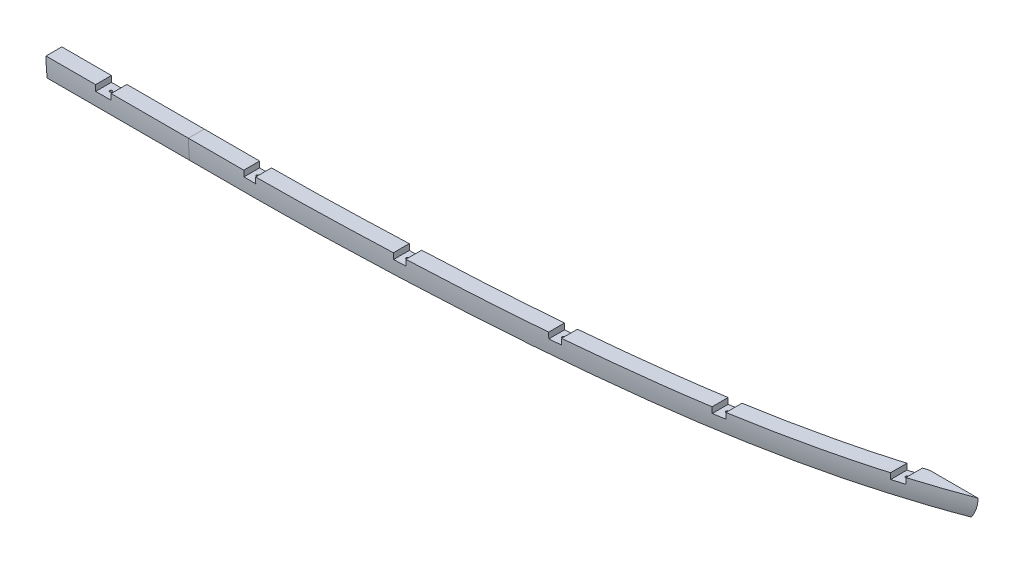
SolidWorks part; units mm, degrees
ref_plane "FRONT" through (0, 0, 0) normal (0, 0, 1) x (1, 0, 0)
ref_plane "TOP" through (0, 0, 0) normal (0, 1, 0) x (1, 0, 0)
ref_plane "SIDE" through (0, 0, 0) normal (1, 0, 0) x (0, 0, -1)
sketch "Sketch2" plane through (0, 0, 0) normal (0, 0, 1) x (1, 0, 0)
  line L0 (1096.3058, -108.5042) -> (1096.3058, 0) construction
  line L2 (1096.3058, 0) -> (-101.6, 0) construction
  line L3 (1096.3058, -31.75) -> (1096.3058, 0)
  line L4 (-101.6, 0) -> (-101.6, -31.75)
  line L5 (1096.3058, 0) -> (-101.6, 0)
  line L6 (-101.6, -31.75) -> (1096.3058, -31.75)
  dimension "D1" = 31.75
extrude "Base-Extrude" add sketch "Sketch2" along normal up to surface (96.5116 mm away)
sketch "Sketch3" plane through (0, 0, 0) normal (0, 1, 0) x (1, 0, 0)
  line L3 (954.8763, -127) -> (1096.3058, -127)
  line L6 (-76.2, -25.4) -> (-76.2, -234.95)
  line L7 (1070.9058, -84.7159) -> (1070.9058, -25.4)
  line L8 (1070.9058, -25.4) -> (-76.2, -25.4)
  line L9 (-101.6, 0) -> (-101.6, -260.35)
  line L10 (1096.3058, -101.6) -> (1096.3058, 0)
  line L11 (1096.3058, 0) -> (-101.6, 0)
  line L12 (-101.6, 0) -> (-101.6, -234.9498)
  line L13 (1096.3058, -127) -> (1096.3058, 0)
  line L14 (1096.3058, 0) -> (-101.6, 0)
  spline S2 degree 3 poles (-2075.5033, -192.8433) (-1384.2296, -236.1888) (-693.7903, -234.9156) (2.7463, -234.9512) (8.8189, -234.938) (20.9633, -234.8786) (39.1792, -234.7437) (57.3927, -234.4825) (93.8171, -233.8203) (118.0965, -233.1924) (166.6512, -231.7161) (190.9267, -230.8773) (239.4732, -228.9573) (263.7431, -227.8748) (312.2578, -225.4156) (336.5047, -224.0398) (384.9732, -220.9355) (409.1949, -219.2069) (457.6084, -215.335) (481.7999, -213.1855) (518.0644, -209.6435) (530.1489, -208.4106) (554.3104, -205.8426) (566.3812, -204.5109) (602.5516, -200.3413) (626.6096, -197.322) (674.5532, -190.5397) (698.4367, -186.7671) (734.1294, -180.5375) (746.005, -178.366) (769.7123, -173.8337) (781.5439, -171.4726) (816.9646, -164.0697) (840.4796, -158.7077) (887.2674, -146.9401) (910.5413, -140.5382) (945.2526, -130.0753) (956.7896, -126.4434) (979.7944, -118.8811) (1002.7307, -111.0235) (1025.5328, -102.5867) (1042.5849, -96.0459) (1048.2607, -93.8301) (1358.8492, 29.528) (1640.9136, 249.2241) (1619.2561, 1778.9924) knots -1.714028 -1.714028 -1.714028 -1.714028 0.0625 0.0625 0.078125 0.078125 0.09375 0.125 0.125 0.1875 0.1875 0.25 0.25 0.3125 0.3125 0.375 0.375 0.4375 0.4375 0.5 0.5 0.53125 0.53125 0.5625 0.5625 0.625 0.625 0.6875 0.6875 0.71875 0.71875 0.75 0.75 0.8125 0.8125 0.875 0.875 0.90625 0.90625 0.9375 0.96875 0.96875 0.984375 0.984375 1.825006 1.825006 1.825006 1.825006 only from (-76.2, -234.95) to (1070.9058, -84.7159)
  spline S3 degree 3 poles (-101.6, -234.9498) (-68.8422, -234.9505) (-36.0843, -234.9492) (2.7463, -234.9512) (8.8189, -234.938) (20.9633, -234.8786) (39.1792, -234.7437) (57.3927, -234.4825) (93.8171, -233.8203) (118.0965, -233.1924) (166.6512, -231.7161) (190.9267, -230.8773) (239.4732, -228.9573) (263.7431, -227.8748) (312.2578, -225.4156) (336.5047, -224.0398) (384.9732, -220.9355) (409.1949, -219.2069) (457.6084, -215.335) (481.7999, -213.1855) (518.0644, -209.6435) (530.1489, -208.4106) (554.3104, -205.8426) (566.3812, -204.5109) (602.5516, -200.3413) (626.6096, -197.322) (674.5532, -190.5397) (698.4367, -186.7671) (734.1294, -180.5375) (746.005, -178.366) (769.7123, -173.8337) (781.5439, -171.4726) (816.9646, -164.0697) (840.4796, -158.7077) (887.2674, -146.9401) (910.5413, -140.5382) (940.7595, -131.4296) (947.8242, -129.2424) (954.8763, -127) knots -0.021784 -0.021784 -0.021784 -0.021784 0.0625 0.0625 0.078125 0.078125 0.09375 0.125 0.125 0.1875 0.1875 0.25 0.25 0.3125 0.3125 0.375 0.375 0.4375 0.4375 0.5 0.5 0.53125 0.53125 0.5625 0.5625 0.625 0.625 0.6875 0.6875 0.71875 0.71875 0.75 0.75 0.8125 0.8125 0.875 0.875 0.894115 0.894115 0.894115 0.894115
  spline S4 degree 3 poles (-1101.5928, -260.3563) (-766.7974, -260.3499) (-427.1241, -260.35) (-84.6282, -260.35) (-73.7157, -260.35) (-64.9869, -260.35) (-55.2318, -260.35) (-45.8615, -260.35) (-36.2371, -260.35) (-26.098, -260.3499) (-16.5997, -260.3503) (-7.4286, -260.3494) (48.1876, -260.3766) (152.4536, -257.9948) (304.9049, -251.8687) (440.4246, -242.8582) (558.943, -231.2687) (660.7144, -218.9237) (762.46, -201.8792) (864.3734, -180.001) (966.3591, -151.3553) (1270.7847, -41.444) (1513.0061, 129.3288) (1421.8918, 843.8887) knots 0.068232 0.068232 0.068232 0.068232 0.475856 0.481795 0.485232 0.489143 0.492423 0.497109 0.500552 0.504141 0.509454 0.512116 0.515307 0.577168 0.639073 0.701068 0.742497 0.784051 0.82586 0.868058 0.910905 0.954729 1.2618 1.2618 1.2618 1.2618 only from (-101.6, -260.35) to (1096.3058, -101.6)
  dimension "D3" = 127
  dimension "D1" = 25.4
  dimension "D2" = 0
extrude "Cut-Extrude1" cut sketch "Sketch3" against normal through all
sketch "Sketch8" plane through (-101.6, 0, 0) normal (-1, 0, 0) x (0, 0, 1)
  line L0 (260.35, 0) -> (234.9498, 0) construction
  line L1 (258.4068, -31.75) -> (234.9498, -31.75) construction
  line L2 (234.9498, -31.75) -> (234.9498, 0) construction
  line L3 (260.35, 0) -> (234.9498, 0)
  line L4 (258.4068, -31.75) -> (234.9498, -31.75)
  line L5 (234.9498, -31.75) -> (234.9498, 0)
  arc A0 (258.4068, -31.75) -> (260.35, 0) centre (0, 0) ccw construction
  arc A1 (258.4068, -31.75) -> (260.35, 0) centre (0, 0) ccw
extrude "Extrude1" add sketch "Sketch8" along normal blind 228.6 separate body
sketch "Sketch4" plane through (0, 0, 0) normal (0, 1, 0) x (1, 0, 0)
  line L0 (927.1, -109.0179) -> (946.15, -103.4386)
  line L1 (692.15, -161.9249) -> (711.2, -158.745)
  line L2 (-12.7, -209.5505) -> (-12.7, -285.7509)
  line L3 (6.35, -209.5394) -> (6.35, -285.7397)
  line L4 (1173.3765, -101.6) -> (950.9352, -101.6)
  line L5 (-127, -209.5492) -> (-127, -285.75)
  line L6 (927.1, -109.0179) -> (927.1, -188.44)
  line L7 (222.25, -204.2149) -> (222.25, -280.4764)
  line L8 (241.3, -203.4132) -> (241.3, -279.6839)
  line L9 (457.2, -189.804) -> (457.2, -266.2835)
  line L10 (476.25, -188.1157) -> (476.25, -264.6254)
  line L11 (692.15, -161.9249) -> (692.15, -239.0904)
  line L12 (711.2, -158.745) -> (711.2, -236.0187)
  line L13 (946.15, -103.4386) -> (946.15, -182.8606)
  line L14 (946.15, -182.8606) -> (946.15, 0) construction
  line L15 (711.2, -236.0187) -> (711.2, 0) construction
  line L16 (476.25, -264.6254) -> (476.25, 0) construction
  line L17 (241.3, -279.6839) -> (241.3, 0) construction
  line L18 (6.35, -285.7397) -> (6.35, 0) construction
  line L19 (6.35, 0) -> (241.3, 0) construction
  line L20 (241.3, 0) -> (476.25, 0) construction
  line L21 (476.25, 0) -> (711.2, 0) construction
  line L22 (711.2, 0) -> (946.15, 0) construction
  line L23 (-12.7, -247.6507) -> (6.35, -247.6395) construction
  line L24 (927.1, -148.7289) -> (946.15, -148.7289) construction
  line L25 (692.15, -200.5076) -> (711.2, -200.5076) construction
  line L26 (457.2, -228.0437) -> (476.25, -228.0437) construction
  line L27 (222.25, -242.3457) -> (241.3, -242.3457) construction
  line L28 (6.35, -247.6395) -> (6.35, -266.6895) construction
  line L30 (-3.175, -247.6451) -> (-3.175, -319.1302) construction
  line L31 (-101.6, -260.35) -> (-101.6, -234.9498) construction
  line L32 (936.625, -148.7289) -> (936.625, -53.2732) construction
  spline S0 degree 3 poles (-127, -285.75) (-99.4053, -285.75) (-71.8105, -285.75) (-30.4184, -285.75) (-16.621, -285.7512) (4.0751, -285.7507) (10.9735, -285.7322) (24.7701, -285.6545) (31.6681, -285.5964) (66.1574, -285.2189) (93.7458, -284.637) (135.1256, -283.507) (148.9184, -283.0882) (176.5034, -282.1889) (190.2943, -281.7058) (231.6603, -280.1433) (259.2292, -278.9504) (314.3463, -276.191) (341.8945, -274.6258) (396.9655, -271.0385) (424.4882, -269.0162) (479.5034, -264.4259) (506.9804, -261.8547) (548.1437, -257.606) (561.8568, -256.1266) (589.2659, -253.031) (602.9614, -251.4111) (630.3282, -247.9793) (643.9996, -246.1675) (671.3121, -242.3042) (684.953, -240.2502) (712.2037, -235.8943) (725.8135, -233.5929) (746.2049, -229.9555) (752.9983, -228.7121) (766.5638, -226.166) (773.3376, -224.8633) (807.1602, -218.1951) (834.0683, -212.3617) (887.5099, -199.4481) (914.0419, -192.3632) (953.5263, -180.6926) (966.6355, -176.6283) (992.7444, -168.1359) (1005.7447, -163.7094) (1025.166, -156.8064) (1031.6266, -154.4614) (1041.2979, -150.879) (1044.5183, -149.6735) (1050.9612, -147.2699) (1067.0685, -141.2607) (1108.9474, -125.6368) (1147.6048, -111.2147) (1173.3765, -101.6) knots 0 0 0 0 0.0625 0.0625 0.09375 0.09375 0.109375 0.109375 0.125 0.125 0.1875 0.1875 0.21875 0.21875 0.25 0.25 0.3125 0.3125 0.375 0.375 0.4375 0.4375 0.5 0.5 0.53125 0.53125 0.5625 0.5625 0.59375 0.59375 0.625 0.625 0.65625 0.65625 0.671875 0.671875 0.6875 0.6875 0.75 0.75 0.8125 0.8125 0.84375 0.84375 0.875 0.875 0.890625 0.890625 0.898437 0.898437 0.90625 0.9375 1 1 1 1 only from (927.1, -188.44) to (946.15, -182.8606)
  spline S2 degree 3 poles (950.9352, -101.6) (948.2319, -102.4596) (945.5289, -103.3209) (940.1182, -105.0224) (937.4109, -105.865) (929.2834, -108.3682) (923.8576, -110.0044) (907.558, -114.8179) (896.6623, -117.9001) (874.815, -123.8227) (863.8634, -126.6633) (841.907, -132.1141) (830.9021, -134.7245) (797.8149, -142.2411) (775.6599, -146.833) (731.1934, -155.3412) (708.8823, -159.2584) (675.298, -164.6254) (664.0923, -166.3283) (641.6629, -169.562) (630.4385, -171.0921) (596.7414, -175.4679) (574.2448, -178.0999) (529.2124, -183.0138) (506.6767, -185.296) (461.5637, -189.488) (438.9861, -191.3963) (371.193, -196.5794) (325.9603, -199.3308) (235.4452, -203.8281) (190.162, -205.572) (122.2106, -207.6635) (99.5591, -208.2685) (54.2534, -209.1657) (31.599, -209.4599) (6.1105, -209.5411) (3.2784, -209.5468) (-2.3858, -209.5518) (-5.2179, -209.5508) (-13.7144, -209.5504) (-30.7072, -209.5499) (-47.7001, -209.5499) (-81.6857, -209.55) (-104.3429, -209.5497) (-127, -209.5492) knots 0 0 0 0 0.007812 0.007812 0.015625 0.015625 0.03125 0.03125 0.0625 0.0625 0.09375 0.09375 0.125 0.125 0.1875 0.1875 0.25 0.25 0.28125 0.28125 0.3125 0.3125 0.375 0.375 0.4375 0.4375 0.5 0.5 0.625 0.625 0.75 0.75 0.8125 0.8125 0.875 0.875 0.882812 0.882812 0.890625 0.890625 0.90625 0.9375 0.9375 1 1 1 1 only from (6.35, -209.5394) to (-12.7, -209.5505)
  spline S3 degree 3 poles (-127, -285.75) (-99.4053, -285.75) (-71.8105, -285.75) (-30.4184, -285.75) (-16.621, -285.7512) (4.0751, -285.7507) (10.9735, -285.7322) (24.7701, -285.6545) (31.6681, -285.5964) (66.1574, -285.2189) (93.7458, -284.637) (135.1256, -283.507) (148.9184, -283.0882) (176.5034, -282.1889) (190.2943, -281.7058) (231.6603, -280.1433) (259.2292, -278.9504) (314.3463, -276.191) (341.8945, -274.6258) (396.9655, -271.0385) (424.4882, -269.0162) (479.5034, -264.4259) (506.9804, -261.8547) (548.1437, -257.606) (561.8568, -256.1266) (589.2659, -253.031) (602.9614, -251.4111) (630.3282, -247.9793) (643.9996, -246.1675) (671.3121, -242.3042) (684.953, -240.2502) (712.2037, -235.8943) (725.8135, -233.5929) (746.2049, -229.9555) (752.9983, -228.7121) (766.5638, -226.166) (773.3376, -224.8633) (807.1602, -218.1951) (834.0683, -212.3617) (887.5099, -199.4481) (914.0419, -192.3632) (953.5263, -180.6926) (966.6355, -176.6283) (992.7444, -168.1359) (1005.7447, -163.7094) (1025.166, -156.8064) (1031.6266, -154.4614) (1041.2979, -150.879) (1044.5183, -149.6735) (1050.9612, -147.2699) (1067.0685, -141.2607) (1108.9474, -125.6368) (1147.6048, -111.2147) (1173.3765, -101.6) knots 0 0 0 0 0.0625 0.0625 0.09375 0.09375 0.109375 0.109375 0.125 0.125 0.1875 0.1875 0.21875 0.21875 0.25 0.25 0.3125 0.3125 0.375 0.375 0.4375 0.4375 0.5 0.5 0.53125 0.53125 0.5625 0.5625 0.59375 0.59375 0.625 0.625 0.65625 0.65625 0.671875 0.671875 0.6875 0.6875 0.75 0.75 0.8125 0.8125 0.84375 0.84375 0.875 0.875 0.890625 0.890625 0.898437 0.898437 0.90625 0.9375 1 1 1 1 only from (222.25, -280.4764) to (241.3, -279.6839)
  spline S4 degree 3 poles (-127, -285.75) (-99.4053, -285.75) (-71.8105, -285.75) (-30.4184, -285.75) (-16.621, -285.7512) (4.0751, -285.7507) (10.9735, -285.7322) (24.7701, -285.6545) (31.6681, -285.5964) (66.1574, -285.2189) (93.7458, -284.637) (135.1256, -283.507) (148.9184, -283.0882) (176.5034, -282.1889) (190.2943, -281.7058) (231.6603, -280.1433) (259.2292, -278.9504) (314.3463, -276.191) (341.8945, -274.6258) (396.9655, -271.0385) (424.4882, -269.0162) (479.5034, -264.4259) (506.9804, -261.8547) (548.1437, -257.606) (561.8568, -256.1266) (589.2659, -253.031) (602.9614, -251.4111) (630.3282, -247.9793) (643.9996, -246.1675) (671.3121, -242.3042) (684.953, -240.2502) (712.2037, -235.8943) (725.8135, -233.5929) (746.2049, -229.9555) (752.9983, -228.7121) (766.5638, -226.166) (773.3376, -224.8633) (807.1602, -218.1951) (834.0683, -212.3617) (887.5099, -199.4481) (914.0419, -192.3632) (953.5263, -180.6926) (966.6355, -176.6283) (992.7444, -168.1359) (1005.7447, -163.7094) (1025.166, -156.8064) (1031.6266, -154.4614) (1041.2979, -150.879) (1044.5183, -149.6735) (1050.9612, -147.2699) (1067.0685, -141.2607) (1108.9474, -125.6368) (1147.6048, -111.2147) (1173.3765, -101.6) knots 0 0 0 0 0.0625 0.0625 0.09375 0.09375 0.109375 0.109375 0.125 0.125 0.1875 0.1875 0.21875 0.21875 0.25 0.25 0.3125 0.3125 0.375 0.375 0.4375 0.4375 0.5 0.5 0.53125 0.53125 0.5625 0.5625 0.59375 0.59375 0.625 0.625 0.65625 0.65625 0.671875 0.671875 0.6875 0.6875 0.75 0.75 0.8125 0.8125 0.84375 0.84375 0.875 0.875 0.890625 0.890625 0.898437 0.898437 0.90625 0.9375 1 1 1 1
  spline S5 degree 3 poles (950.9352, -101.6) (948.2319, -102.4596) (945.5289, -103.3209) (940.1182, -105.0224) (937.4109, -105.865) (929.2834, -108.3682) (923.8576, -110.0044) (907.558, -114.8179) (896.6623, -117.9001) (874.815, -123.8227) (863.8634, -126.6633) (841.907, -132.1141) (830.9021, -134.7245) (797.8149, -142.2411) (775.6599, -146.833) (731.1934, -155.3412) (708.8823, -159.2584) (675.298, -164.6254) (664.0923, -166.3283) (641.6629, -169.562) (630.4385, -171.0921) (596.7414, -175.4679) (574.2448, -178.0999) (529.2124, -183.0138) (506.6767, -185.296) (461.5637, -189.488) (438.9861, -191.3963) (371.193, -196.5794) (325.9603, -199.3308) (235.4452, -203.8281) (190.162, -205.572) (122.2106, -207.6635) (99.5591, -208.2685) (54.2534, -209.1657) (31.599, -209.4599) (6.1105, -209.5411) (3.2784, -209.5468) (-2.3858, -209.5518) (-5.2179, -209.5508) (-13.7144, -209.5504) (-30.7072, -209.5499) (-47.7001, -209.5499) (-81.6857, -209.55) (-104.3429, -209.5497) (-127, -209.5492) knots 0 0 0 0 0.007812 0.007812 0.015625 0.015625 0.03125 0.03125 0.0625 0.0625 0.09375 0.09375 0.125 0.125 0.1875 0.1875 0.25 0.25 0.28125 0.28125 0.3125 0.3125 0.375 0.375 0.4375 0.4375 0.5 0.5 0.625 0.625 0.75 0.75 0.8125 0.8125 0.875 0.875 0.882812 0.882812 0.890625 0.890625 0.90625 0.9375 0.9375 1 1 1 1
  spline S6 degree 3 poles (-127, -285.75) (-99.4053, -285.75) (-71.8105, -285.75) (-30.4184, -285.75) (-16.621, -285.7512) (4.0751, -285.7507) (10.9735, -285.7322) (24.7701, -285.6545) (31.6681, -285.5964) (66.1574, -285.2189) (93.7458, -284.637) (135.1256, -283.507) (148.9184, -283.0882) (176.5034, -282.1889) (190.2943, -281.7058) (231.6603, -280.1433) (259.2292, -278.9504) (314.3463, -276.191) (341.8945, -274.6258) (396.9655, -271.0385) (424.4882, -269.0162) (479.5034, -264.4259) (506.9804, -261.8547) (548.1437, -257.606) (561.8568, -256.1266) (589.2659, -253.031) (602.9614, -251.4111) (630.3282, -247.9793) (643.9996, -246.1675) (671.3121, -242.3042) (684.953, -240.2502) (712.2037, -235.8943) (725.8135, -233.5929) (746.2049, -229.9555) (752.9983, -228.7121) (766.5638, -226.166) (773.3376, -224.8633) (807.1602, -218.1951) (834.0683, -212.3617) (887.5099, -199.4481) (914.0419, -192.3632) (953.5263, -180.6926) (966.6355, -176.6283) (992.7444, -168.1359) (1005.7447, -163.7094) (1025.166, -156.8064) (1031.6266, -154.4614) (1041.2979, -150.879) (1044.5183, -149.6735) (1050.9612, -147.2699) (1067.0685, -141.2607) (1108.9474, -125.6368) (1147.6048, -111.2147) (1173.3765, -101.6) knots 0 0 0 0 0.0625 0.0625 0.09375 0.09375 0.109375 0.109375 0.125 0.125 0.1875 0.1875 0.21875 0.21875 0.25 0.25 0.3125 0.3125 0.375 0.375 0.4375 0.4375 0.5 0.5 0.53125 0.53125 0.5625 0.5625 0.59375 0.59375 0.625 0.625 0.65625 0.65625 0.671875 0.671875 0.6875 0.6875 0.75 0.75 0.8125 0.8125 0.84375 0.84375 0.875 0.875 0.890625 0.890625 0.898437 0.898437 0.90625 0.9375 1 1 1 1 only from (-12.7, -285.7509) to (6.35, -285.7397)
  spline S7 degree 3 poles (950.9352, -101.6) (948.2319, -102.4596) (945.5289, -103.3209) (940.1182, -105.0224) (937.4109, -105.865) (929.2834, -108.3682) (923.8576, -110.0044) (907.558, -114.8179) (896.6623, -117.9001) (874.815, -123.8227) (863.8634, -126.6633) (841.907, -132.1141) (830.9021, -134.7245) (797.8149, -142.2411) (775.6599, -146.833) (731.1934, -155.3412) (708.8823, -159.2584) (675.298, -164.6254) (664.0923, -166.3283) (641.6629, -169.562) (630.4385, -171.0921) (596.7414, -175.4679) (574.2448, -178.0999) (529.2124, -183.0138) (506.6767, -185.296) (461.5637, -189.488) (438.9861, -191.3963) (371.193, -196.5794) (325.9603, -199.3308) (235.4452, -203.8281) (190.162, -205.572) (122.2106, -207.6635) (99.5591, -208.2685) (54.2534, -209.1657) (31.599, -209.4599) (6.1105, -209.5411) (3.2784, -209.5468) (-2.3858, -209.5518) (-5.2179, -209.5508) (-13.7144, -209.5504) (-30.7072, -209.5499) (-47.7001, -209.5499) (-81.6857, -209.55) (-104.3429, -209.5497) (-127, -209.5492) knots 0 0 0 0 0.007812 0.007812 0.015625 0.015625 0.03125 0.03125 0.0625 0.0625 0.09375 0.09375 0.125 0.125 0.1875 0.1875 0.25 0.25 0.28125 0.28125 0.3125 0.3125 0.375 0.375 0.4375 0.4375 0.5 0.5 0.625 0.625 0.75 0.75 0.8125 0.8125 0.875 0.875 0.882812 0.882812 0.890625 0.890625 0.90625 0.9375 0.9375 1 1 1 1 only from (927.1, -109.0179) to (692.15, -161.9249) construction
  spline S8 degree 3 poles (-127, -285.75) (-99.4053, -285.75) (-71.8105, -285.75) (-30.4184, -285.75) (-16.621, -285.7512) (4.0751, -285.7507) (10.9735, -285.7322) (24.7701, -285.6545) (31.6681, -285.5964) (66.1574, -285.2189) (93.7458, -284.637) (135.1256, -283.507) (148.9184, -283.0882) (176.5034, -282.1889) (190.2943, -281.7058) (231.6603, -280.1433) (259.2292, -278.9504) (314.3463, -276.191) (341.8945, -274.6258) (396.9655, -271.0385) (424.4882, -269.0162) (479.5034, -264.4259) (506.9804, -261.8547) (548.1437, -257.606) (561.8568, -256.1266) (589.2659, -253.031) (602.9614, -251.4111) (630.3282, -247.9793) (643.9996, -246.1675) (671.3121, -242.3042) (684.953, -240.2502) (712.2037, -235.8943) (725.8135, -233.5929) (746.2049, -229.9555) (752.9983, -228.7121) (766.5638, -226.166) (773.3376, -224.8633) (807.1602, -218.1951) (834.0683, -212.3617) (887.5099, -199.4481) (914.0419, -192.3632) (953.5263, -180.6926) (966.6355, -176.6283) (992.7444, -168.1359) (1005.7447, -163.7094) (1025.166, -156.8064) (1031.6266, -154.4614) (1041.2979, -150.879) (1044.5183, -149.6735) (1050.9612, -147.2699) (1067.0685, -141.2607) (1108.9474, -125.6368) (1147.6048, -111.2147) (1173.3765, -101.6) knots 0 0 0 0 0.0625 0.0625 0.09375 0.09375 0.109375 0.109375 0.125 0.125 0.1875 0.1875 0.21875 0.21875 0.25 0.25 0.3125 0.3125 0.375 0.375 0.4375 0.4375 0.5 0.5 0.53125 0.53125 0.5625 0.5625 0.59375 0.59375 0.625 0.625 0.65625 0.65625 0.671875 0.671875 0.6875 0.6875 0.75 0.75 0.8125 0.8125 0.84375 0.84375 0.875 0.875 0.890625 0.890625 0.898437 0.898437 0.90625 0.9375 1 1 1 1 only from (457.2, -266.2835) to (476.25, -264.6254)
  spline S9 degree 3 poles (950.9352, -101.6) (948.2319, -102.4596) (945.5289, -103.3209) (940.1182, -105.0224) (937.4109, -105.865) (929.2834, -108.3682) (923.8576, -110.0044) (907.558, -114.8179) (896.6623, -117.9001) (874.815, -123.8227) (863.8634, -126.6633) (841.907, -132.1141) (830.9021, -134.7245) (797.8149, -142.2411) (775.6599, -146.833) (731.1934, -155.3412) (708.8823, -159.2584) (675.298, -164.6254) (664.0923, -166.3283) (641.6629, -169.562) (630.4385, -171.0921) (596.7414, -175.4679) (574.2448, -178.0999) (529.2124, -183.0138) (506.6767, -185.296) (461.5637, -189.488) (438.9861, -191.3963) (371.193, -196.5794) (325.9603, -199.3308) (235.4452, -203.8281) (190.162, -205.572) (122.2106, -207.6635) (99.5591, -208.2685) (54.2534, -209.1657) (31.599, -209.4599) (6.1105, -209.5411) (3.2784, -209.5468) (-2.3858, -209.5518) (-5.2179, -209.5508) (-13.7144, -209.5504) (-30.7072, -209.5499) (-47.7001, -209.5499) (-81.6857, -209.55) (-104.3429, -209.5497) (-127, -209.5492) knots 0 0 0 0 0.007812 0.007812 0.015625 0.015625 0.03125 0.03125 0.0625 0.0625 0.09375 0.09375 0.125 0.125 0.1875 0.1875 0.25 0.25 0.28125 0.28125 0.3125 0.3125 0.375 0.375 0.4375 0.4375 0.5 0.5 0.625 0.625 0.75 0.75 0.8125 0.8125 0.875 0.875 0.882812 0.882812 0.890625 0.890625 0.90625 0.9375 0.9375 1 1 1 1 only from (241.3, -203.4132) to (222.25, -204.2149)
  spline S10 degree 3 poles (-127, -285.75) (-99.4053, -285.75) (-71.8105, -285.75) (-30.4184, -285.75) (-16.621, -285.7512) (4.0751, -285.7507) (10.9735, -285.7322) (24.7701, -285.6545) (31.6681, -285.5964) (66.1574, -285.2189) (93.7458, -284.637) (135.1256, -283.507) (148.9184, -283.0882) (176.5034, -282.1889) (190.2943, -281.7058) (231.6603, -280.1433) (259.2292, -278.9504) (314.3463, -276.191) (341.8945, -274.6258) (396.9655, -271.0385) (424.4882, -269.0162) (479.5034, -264.4259) (506.9804, -261.8547) (548.1437, -257.606) (561.8568, -256.1266) (589.2659, -253.031) (602.9614, -251.4111) (630.3282, -247.9793) (643.9996, -246.1675) (671.3121, -242.3042) (684.953, -240.2502) (712.2037, -235.8943) (725.8135, -233.5929) (746.2049, -229.9555) (752.9983, -228.7121) (766.5638, -226.166) (773.3376, -224.8633) (807.1602, -218.1951) (834.0683, -212.3617) (887.5099, -199.4481) (914.0419, -192.3632) (953.5263, -180.6926) (966.6355, -176.6283) (992.7444, -168.1359) (1005.7447, -163.7094) (1025.166, -156.8064) (1031.6266, -154.4614) (1041.2979, -150.879) (1044.5183, -149.6735) (1050.9612, -147.2699) (1067.0685, -141.2607) (1108.9474, -125.6368) (1147.6048, -111.2147) (1173.3765, -101.6) knots 0 0 0 0 0.0625 0.0625 0.09375 0.09375 0.109375 0.109375 0.125 0.125 0.1875 0.1875 0.21875 0.21875 0.25 0.25 0.3125 0.3125 0.375 0.375 0.4375 0.4375 0.5 0.5 0.53125 0.53125 0.5625 0.5625 0.59375 0.59375 0.625 0.625 0.65625 0.65625 0.671875 0.671875 0.6875 0.6875 0.75 0.75 0.8125 0.8125 0.84375 0.84375 0.875 0.875 0.890625 0.890625 0.898437 0.898437 0.90625 0.9375 1 1 1 1 only from (692.15, -239.0904) to (711.2, -236.0187)
  spline S11 degree 3 poles (950.9352, -101.6) (948.2319, -102.4596) (945.5289, -103.3209) (940.1182, -105.0224) (937.4109, -105.865) (929.2834, -108.3682) (923.8576, -110.0044) (907.558, -114.8179) (896.6623, -117.9001) (874.815, -123.8227) (863.8634, -126.6633) (841.907, -132.1141) (830.9021, -134.7245) (797.8149, -142.2411) (775.6599, -146.833) (731.1934, -155.3412) (708.8823, -159.2584) (675.298, -164.6254) (664.0923, -166.3283) (641.6629, -169.562) (630.4385, -171.0921) (596.7414, -175.4679) (574.2448, -178.0999) (529.2124, -183.0138) (506.6767, -185.296) (461.5637, -189.488) (438.9861, -191.3963) (371.193, -196.5794) (325.9603, -199.3308) (235.4452, -203.8281) (190.162, -205.572) (122.2106, -207.6635) (99.5591, -208.2685) (54.2534, -209.1657) (31.599, -209.4599) (6.1105, -209.5411) (3.2784, -209.5468) (-2.3858, -209.5518) (-5.2179, -209.5508) (-13.7144, -209.5504) (-30.7072, -209.5499) (-47.7001, -209.5499) (-81.6857, -209.55) (-104.3429, -209.5497) (-127, -209.5492) knots 0 0 0 0 0.007812 0.007812 0.015625 0.015625 0.03125 0.03125 0.0625 0.0625 0.09375 0.09375 0.125 0.125 0.1875 0.1875 0.25 0.25 0.28125 0.28125 0.3125 0.3125 0.375 0.375 0.4375 0.4375 0.5 0.5 0.625 0.625 0.75 0.75 0.8125 0.8125 0.875 0.875 0.882812 0.882812 0.890625 0.890625 0.90625 0.9375 0.9375 1 1 1 1 only from (476.25, -188.1157) to (457.2, -189.804)
  dimension "D2" = 234.95
  dimension "D3" = 19.05
  dimension "D6" = 98.425
  dimension "D7" = 96.0014
  dimension "D1" = 25.4
extrude "Cut-Extrude2" cut sketch "Sketch4" against normal blind 9.525
hole_wizard "#8-32 Tapped Hole1" positions "Sketch7" profile "Sketch6" tap size "#8-32" standard "Ansi Inch"
sketch "Sketch7" plane through (0, -9.525, 0) normal (0, 1, 0) x (-1, 0, 0)
  line L0 (101.6, 260.35) -> (101.6, 234.9498) construction
  line L15 (-936.625, 135.5304) -> (-936.625, 162.0037)
  line L16 (-936.625, 132.6725) -> (-936.625, 162.0037) construction
  line L18 (-701.675, 210.269) -> (-701.675, 184.5112)
  line L19 (-701.675, 210.269) -> (-701.675, 186.1036) construction
  line L21 (-466.725, 239.1238) -> (-466.725, 213.62)
  line L22 (-466.725, 239.1238) -> (-466.725, 214.4703) construction
  line L27 (-231.775, 254.2604) -> (-231.775, 228.8366)
  line L28 (-231.775, 254.2604) -> (-231.775, 229.2424) construction
  line L30 (3.175, 260.34) -> (3.175, 234.9395)
  line L31 (3.175, 260.34) -> (3.175, 234.9395) construction
  spline S0 degree 3 poles (-222.25, 229.635) (-228.6003, 229.3776) (-234.9504, 229.1116) (-241.3, 228.8366) knots 0.256051 0.256051 0.256051 0.256051 0.272403 0.272403 0.272403 0.272403 construction
  spline S1 degree 3 poles (-457.2, 215.2985) (-463.551, 214.7537) (-469.901, 214.1942) (-476.25, 213.62) knots 0.457986 0.457986 0.457986 0.457986 0.474391 0.474391 0.474391 0.474391 construction
  spline S2 degree 3 poles (-692.15, 187.654) (-698.5063, 186.6334) (-704.8563, 185.5858) (-711.2, 184.5111) knots 0.661204 0.661204 0.661204 0.661204 0.677847 0.677847 0.677847 0.677847 construction
  spline S3 degree 3 poles (-928.2654, 148.429) (-934.6789, 146.5396) (-941.0834, 144.6068) (-947.478, 142.6296) knots 0 0 0 0 1 1 1 1 construction
  spline S4 degree 3 poles (-927.1, 135.5305) (-929.2952, 134.8798) (-931.4893, 134.2239) (-937.8424, 132.3089) (-941.9984, 131.0362) (-946.15, 129.7447) knots 0.869077 0.869077 0.869077 0.869077 0.875 0.875 0.886236 0.886236 0.886236 0.886236 construction
  spline S6 degree 3 poles (-698.112, 199.5558) (-704.5042, 198.5178) (-710.8901, 197.4526) (-717.2698, 196.3603) knots 0 0 0 0 1 1 1 1 construction
  spline S9 degree 3 poles (-468.5934, 227.0548) (-474.9639, 226.4924) (-481.3333, 225.9152) (-487.7016, 225.3234) knots 0 0 0 0 1 1 1 1 construction
  spline S12 degree 3 poles (-239.4213, 241.6295) (-245.7837, 241.3562) (-252.1459, 241.074) (-258.5079, 240.7824) knots 0 0 0 0 1 1 1 1 construction
  spline S14 degree 3 poles (12.7004, 247.6505) (11.113, 247.6505) (8.7317, 247.6506) (6.3505, 247.6507) (4.763, 247.6508) (3.9713, 247.6509) (-0.0098, 247.6509) (-3.1952, 247.6473) (-6.3811, 247.6395) knots 0 0 0 0 0.25 0.375 0.375 0.5 0.5 1 1 1 1
  spline S15 degree 3 poles (12.7004, 247.6505) (11.113, 247.6505) (8.7317, 247.6506) (6.3505, 247.6507) (4.763, 247.6508) (3.9713, 247.6509) (-0.0098, 247.6509) (-3.1952, 247.6473) (-6.3811, 247.6395) knots 0 0 0 0 0.25 0.375 0.375 0.5 0.5 1 1 1 1 construction
  point P0 (-936.625, 145.3725)
  point P1 (-701.675, 198.8036)
  point P2 (-466.725, 227.1703)
  point P3 (-231.775, 241.9424)
  point P4 (3.175, 247.6509)
  dimension "D4" = 12.7
  dimension "D2" = 12.7
  dimension "D3" = 12.7
  dimension "D13" = 98.425
  dimension "D14" = 234.95
  dimension "D15" = 234.95
  dimension "D16" = 234.95
  dimension "D17" = 234.95
  dimension "D9" = 12.7
  dimension "D5" = 12.7
  dimension "D6" = 9.525
  dimension "D7" = 9.525
  dimension "D8" = 9.525
  dimension "D10" = 9.525
  dimension "D11" = 9.525
sketch "Sketch6" plane through (936.625, -9.525, 145.3725) normal (1, 0, 0) x (0, 0, 1)
  line L0 (0, 0) -> (0, 13.3314)
  line L1 (0, 13.3314) -> (1.7272, 12.2936)
  line L2 (1.7272, 12.2936) -> (1.7272, 8.3312)
  line L3 (1.7272, 8.3312) -> (2.0828, 8.3312)
  line L4 (2.0828, 8.3312) -> (2.0828, 0)
  line L5 (2.0828, 0) -> (0, 0)
  line L10 (0, 13.3314) -> (-1.7272, 12.2936) construction
  line L11 (0, -6.35) -> (0, 107.95) construction
  dimension "Tap Drill Dia." = 3.4544
  dimension "Tap Drill Depth" = 12.2936
  dimension "Thread Dia." = 4.1656
  dimension "Thread Depth" = 8.3312
  dimension "Drill Angle" = 118
sketch "Sketch9" plane through (0, 0, 0) normal (0, 1, 0) x (-1, 0, 0)
  line L0 (238.125, 282.052) -> (238.125, 130.6202) construction
  line L1 (225.7029, 282.052) -> (250.5471, 282.052)
  line L2 (225.7029, 282.052) -> (225.7029, 209.1701)
  line L3 (225.7029, 209.1701) -> (250.5471, 209.1701)
  line L4 (250.5471, 282.052) -> (250.5471, 209.1701)
  line L5 (225.7029, 245.6111) -> (250.5471, 245.6111) construction
  line L6 (3.175, 247.6509) -> (3.175, 210.4044) construction
  dimension "D1" = 24.8443
  dimension "D2" = 234.95
extrude "Cut-Extrude3" cut sketch "Sketch9" against normal blind 9.525
hole_wizard "#8-32 Tapped Hole2" positions "3DSketch1" profile "Sketch10" tap size "#8-32" standard "Ansi Inch"
sketch3d "3DSketch1"
  line L0 (-3.175, -9.525, 247.6509) -> (-343.1712, -9.525, 247.6509) construction
  circle A0 centre (-3.175, -9.525, 247.6509) radius 2.0828 construction
  point P0 (-238.4882, -9.525, 247.6509)
  point P5 (-3.175, -7.4422, 247.6509)
  point P6 (-206.8699, 0, 188.4729)
  dimension "D1" = 235.3132
sketch "Sketch10" plane through (-238.4882, -9.525, 247.6509) normal (1, 0, 0) x (0, 0, 1)
  line L0 (0, 0) -> (0, 13.3318)
  line L1 (0, 13.3318) -> (1.7272, 12.294)
  line L2 (1.7272, 12.294) -> (1.7272, 8.331)
  line L3 (1.7272, 8.331) -> (2.0828, 8.331)
  line L4 (2.0828, 8.331) -> (2.0828, 0)
  line L5 (2.0828, 0) -> (0, 0)
  line L10 (0, 13.3318) -> (-1.7272, 12.294) construction
  line L11 (0, -6.35) -> (0, 107.95) construction
  dimension "Tap Drill Dia." = 3.4544
  dimension "Tap Drill Depth" = 12.294
  dimension "Thread Major Dia." = 4.1656
  dimension "Thread Depth" = 8.331
  dimension "Drill Angle" = 118
